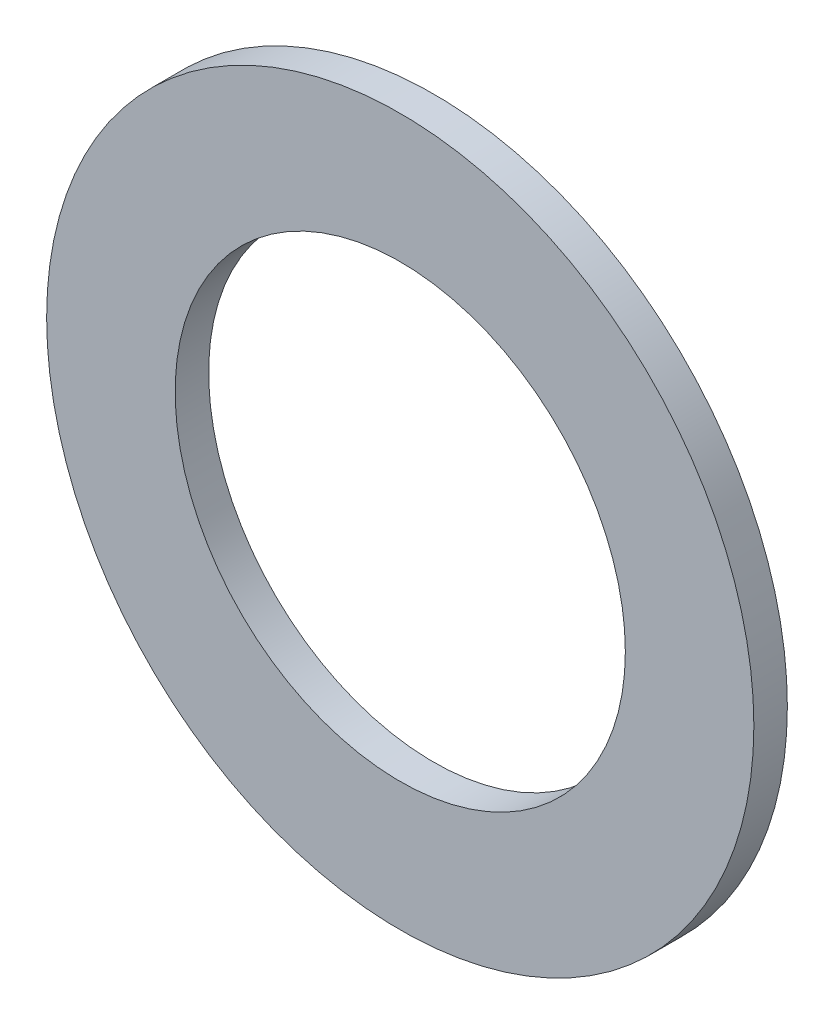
SolidWorks part; units mm, degrees
ref_plane "Plan1" through (0, 0, 0) normal (0, 0, 1) x (1, 0, 0)
ref_plane "Plan2" through (0, 0, 0) normal (0, 1, 0) x (1, 0, 0)
ref_plane "Plan3" through (0, 0, 0) normal (1, 0, 0) x (0, 0, -1)
sketch "Esquisse1" plane through (0, 0, 0) normal (0, 0, 1) x (1, 0, 0)
  circle A0 centre (94.6294, 484.7324) radius 10.5567
  circle A1 centre (94.6294, 484.7324) radius 6.7199
extrude "Base-Extrusion" add sketch "Esquisse1" against normal blind 1
